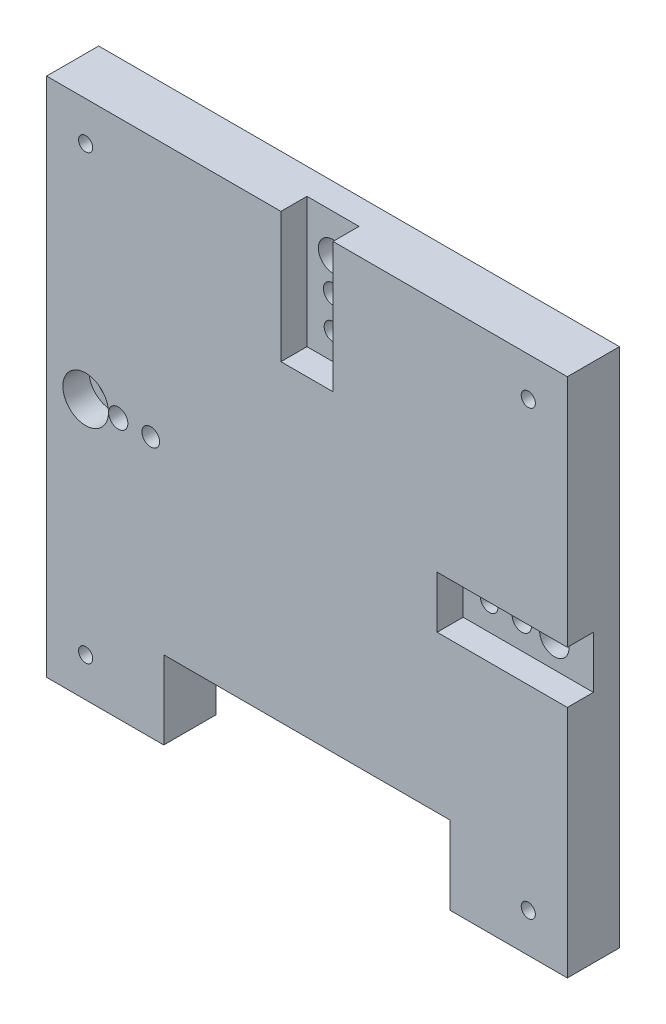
SolidWorks part; units mm, degrees
ref_plane "Front Plane" through (0, 0, 0) normal (0, 0, 1) x (1, 0, 0)
ref_plane "Top Plane" through (0, 0, 0) normal (0, 1, 0) x (1, 0, 0)
ref_plane "Right Plane" through (0, 0, 0) normal (1, 0, 0) x (0, 0, -1)
sketch "Sketch1" plane through (0, 0, 0) normal (0, 0, 1) x (1, 0, 0)
  line L1 (-51.7024, 25.9715) -> (75.2976, 25.9715)
  line L2 (-51.7024, 25.9715) -> (-51.7024, -101.0285)
  line L3 (-51.7024, -101.0285) -> (75.2976, -101.0285)
  line L4 (75.2976, 25.9715) -> (75.2976, -101.0285)
extrude "Boss-Extrude1" add sketch "Sketch1" along normal blind 12.7
hole_wizard "#18 (0.1695) Diameter Hole1" positions "Sketch2" profile "Sketch3" hole size "#18" standard "ANSI Inch"
sketch "Sketch2" plane through (0, 0, 12.7) normal (0, 0, 1) x (1, 0, 0)
  line L0 (-51.7024, 25.9715) -> (-51.7024, -101.0285) construction
  line L1 (75.2976, 25.9715) -> (-51.7024, 25.9715) construction
  line L2 (75.2976, -101.0285) -> (75.2976, 25.9715) construction
  point P0 (-26.3024, -37.5285)
  point P2 (49.8976, -37.5285)
  point P11 (11.7976, 0.5715)
  dimension "D1" = 25.4
  dimension "D2" = 63.5
  dimension "D3" = 25.4
  dimension "D4" = 63.5
  dimension "D5" = 63.5
  dimension "D6" = 25.4
sketch "Sketch3" plane through (-26.3024, -37.5285, 12.7) normal (1, 0, 0) x (0, -1, 0)
  line L0 (0, 0) -> (0, 12.7)
  line L1 (0, 12.7) -> (2.1526, 12.7)
  line L2 (2.1526, 12.7) -> (2.1526, 0)
  line L5 (2.1526, 0) -> (0, 0)
  line L11 (0, -6.35) -> (0, 107.95) construction
  dimension "Thru Hole Dia." = 4.3053
  dimension "Thru Hole Depth" = 12.7
hole_wizard "#13 (0.185) Diameter Hole1" positions "Sketch4" profile "Sketch5" hole size "#13" standard "ANSI Inch"
sketch "Sketch4" plane through (0, 0, 12.7) normal (0, 0, 1) x (1, 0, 0)
  line L0 (-51.7024, 25.9715) -> (-51.7024, -101.0285) construction
  line L1 (75.2976, 25.9715) -> (-51.7024, 25.9715) construction
  line L2 (75.2976, -101.0285) -> (75.2976, 25.9715) construction
  point P0 (-34.2399, -37.5285)
  point P2 (57.8351, -37.5285)
  point P11 (11.7976, 8.509)
  dimension "D1" = 17.4625
  dimension "D2" = 63.5
  dimension "D3" = 63.5
  dimension "D4" = 17.4625
  dimension "D5" = 63.5
  dimension "D6" = 17.4625
sketch "Sketch5" plane through (-34.2399, -37.5285, 12.7) normal (1, 0, 0) x (0, -1, 0)
  line L0 (0, 0) -> (0, 12.7)
  line L1 (0, 12.7) -> (2.3495, 12.7)
  line L2 (2.3495, 12.7) -> (2.3495, 0)
  line L5 (2.3495, 0) -> (0, 0)
  line L11 (0, -6.35) -> (0, 107.95) construction
  dimension "Thru Hole Dia." = 4.699
  dimension "Thru Hole Depth" = 12.7
hole_wizard "9/32 (0.28125) Diameter Hole1" positions "Sketch6" profile "Sketch7" hole size "9/32" standard "ANSI Inch"
sketch "Sketch6" plane through (0, 0, 12.7) normal (0, 0, 1) x (1, 0, 0)
  line L0 (75.2976, 25.9715) -> (-51.7024, 25.9715) construction
  line L1 (75.2976, -101.0285) -> (75.2976, 25.9715) construction
  line L2 (-51.7024, 25.9715) -> (-51.7024, -101.0285) construction
  point P0 (-42.1774, -37.5285)
  point P2 (65.7726, -37.5285)
  point P4 (11.7976, 16.4465)
  dimension "D1" = 63.5
  dimension "D2" = 63.5
  dimension "D3" = 63.5
  dimension "D4" = 9.525
  dimension "D5" = 9.525
  dimension "D6" = 9.525
sketch "Sketch7" plane through (-42.1774, -37.5285, 12.7) normal (1, 0, 0) x (0, -1, 0)
  line L0 (0, 0) -> (0, 12.7)
  line L1 (0, 12.7) -> (3.5719, 12.7)
  line L2 (3.5719, 12.7) -> (3.5719, 0)
  line L5 (3.5719, 0) -> (0, 0)
  line L11 (0, -6.35) -> (0, 107.95) construction
  dimension "Thru Hole Dia." = 7.1437
  dimension "Thru Hole Depth" = 12.7
hole_wizard "#8-32 Tapped Hole1" positions "Sketch8" profile "Sketch9" tap size "#8-32" standard "ANSI Inch"
sketch "Sketch8" plane through (0, 0, 12.7) normal (0, 0, 1) x (1, 0, 0)
  line L0 (75.2976, 25.9715) -> (-51.7024, 25.9715) construction
  line L1 (-51.7024, 25.9715) -> (-51.7024, -101.0285) construction
  line L2 (75.2976, -101.0285) -> (75.2976, 25.9715) construction
  line L3 (-51.7024, -101.0285) -> (75.2976, -101.0285) construction
  point P0 (-42.1774, 16.4465)
  point P2 (65.7726, 16.4465)
  point P4 (65.7726, -91.5035)
  point P6 (-42.1774, -91.5035)
  dimension "D1" = 9.525
  dimension "D2" = 9.525
  dimension "D3" = 9.525
  dimension "D4" = 9.525
  dimension "D5" = 9.525
  dimension "D6" = 9.525
  dimension "D7" = 9.525
  dimension "D8" = 9.525
sketch "Sketch9" plane through (-42.1774, 16.4465, 12.7) normal (1, 0, 0) x (0, -1, 0)
  line L0 (0, 0) -> (0, 12.7)
  line L1 (0, 12.7) -> (1.7272, 12.7)
  line L2 (1.7272, 12.7) -> (1.7272, 0)
  line L5 (1.7272, 0) -> (0, 0)
  line L11 (0, -6.35) -> (0, 107.95) construction
  dimension "Thru Tap Drill Dia." = 3.4544
  dimension "Thru Tap Drill Depth" = 12.7
sketch "Sketch10" plane through (0, 0, 12.7) normal (0, 0, 1) x (1, 0, 0)
  line L5 (75.2976, -101.0285) -> (75.2976, 25.9715) construction
  line L6 (75.2976, -31.1785) -> (43.5476, -31.1785)
  line L7 (75.2976, -31.1785) -> (75.2976, -43.8785)
  line L8 (75.2976, -43.8785) -> (43.5476, -43.8785)
  line L9 (43.5476, -31.1785) -> (43.5476, -43.8785)
  line L10 (75.2976, 25.9715) -> (-51.7024, 25.9715) construction
  line L12 (5.4476, 25.9715) -> (18.1476, 25.9715)
  line L13 (5.4476, 25.9715) -> (5.4476, -5.7785)
  line L14 (5.4476, -5.7785) -> (18.1476, -5.7785)
  line L15 (18.1476, 25.9715) -> (18.1476, -5.7785)
  circle A2 centre (-42.1774, -37.5285) radius 3.5719
  circle A3 centre (-42.1774, -37.5285) radius 3.5719 construction
  circle A4 centre (-42.1774, -37.5285) radius 5.5563
  dimension "D7" = 0
  dimension "D6" = 0
  dimension "D1" = 12.7
  dimension "D2" = 57.15
  dimension "D3" = 12.7
  dimension "D4" = 31.75
  dimension "D5" = 57.15
extrude "Cut-Extrude5" cut sketch "Sketch10" against normal blind 6.35 contours A4 | L13 L12 L15 L14 | L7 L6 L9 L8
sketch "Sketch12" plane through (0, 0, 12.7) normal (0, 0, 1) x (1, 0, 0)
  line L0 (-51.7024, 25.9715) -> (-51.7024, -101.0285) construction
  line L5 (-23.1274, -101.0285) -> (46.7226, -101.0285)
  line L6 (-23.1274, -101.0285) -> (-23.1274, -81.9785)
  line L7 (-23.1274, -81.9785) -> (46.7226, -81.9785)
  line L8 (46.7226, -101.0285) -> (46.7226, -81.9785)
  line L9 (75.2976, -101.0285) -> (75.2976, -43.8785) construction
  dimension "D1" = 28.575
  dimension "D2" = 28.575
  dimension "D3" = 19.05
extrude "Cut-Extrude6" cut sketch "Sketch12" against normal through all
